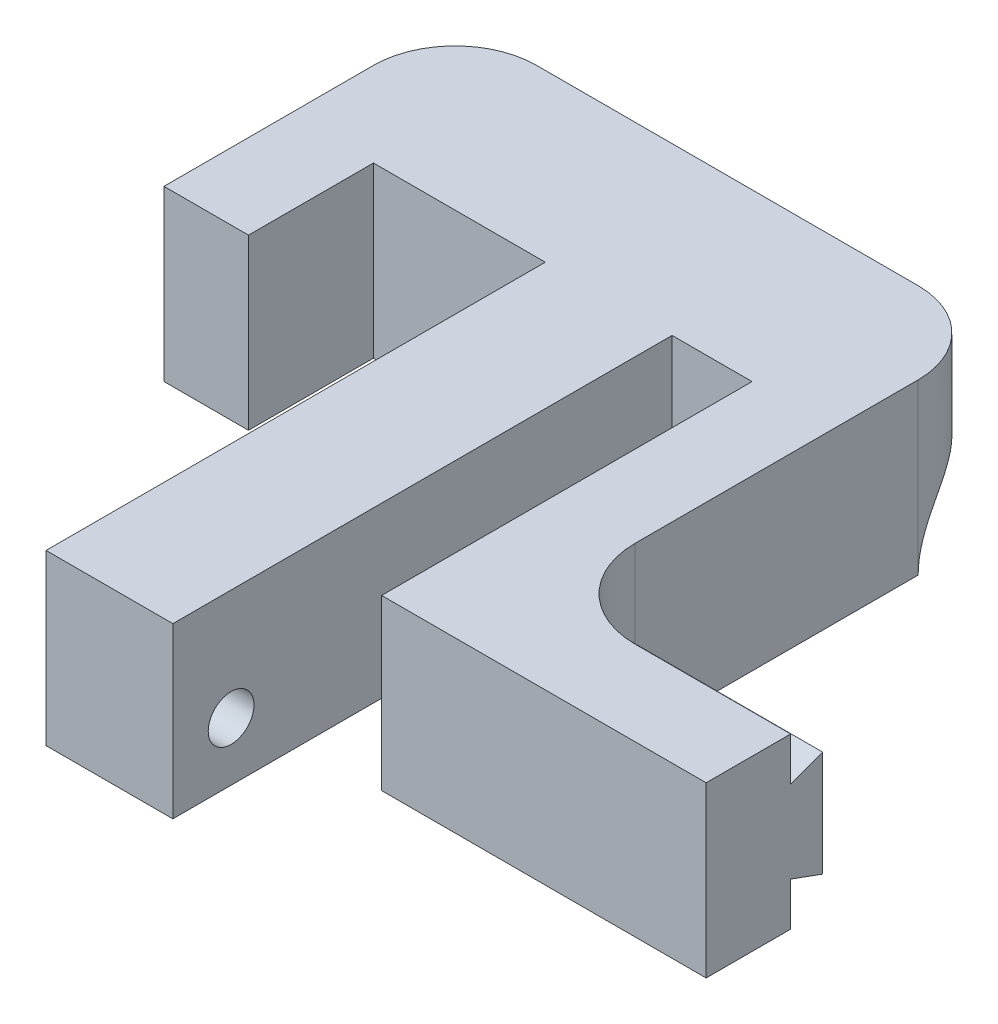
SolidWorks part; units mm, degrees
other "<Connecting Part 2>-<Boss-Extrude2>"
ref_plane "Front Plane" through (0, 0, 0) normal (0, 0, 1) x (1, 0, 0)
ref_plane "Top Plane" through (0, 0, 0) normal (0, 1, 0) x (1, 0, 0)
ref_plane "Right Plane" through (0, 0, 0) normal (1, 0, 0) x (0, 0, -1)
mirrored part "Connecting Part 2_Mirrored"
